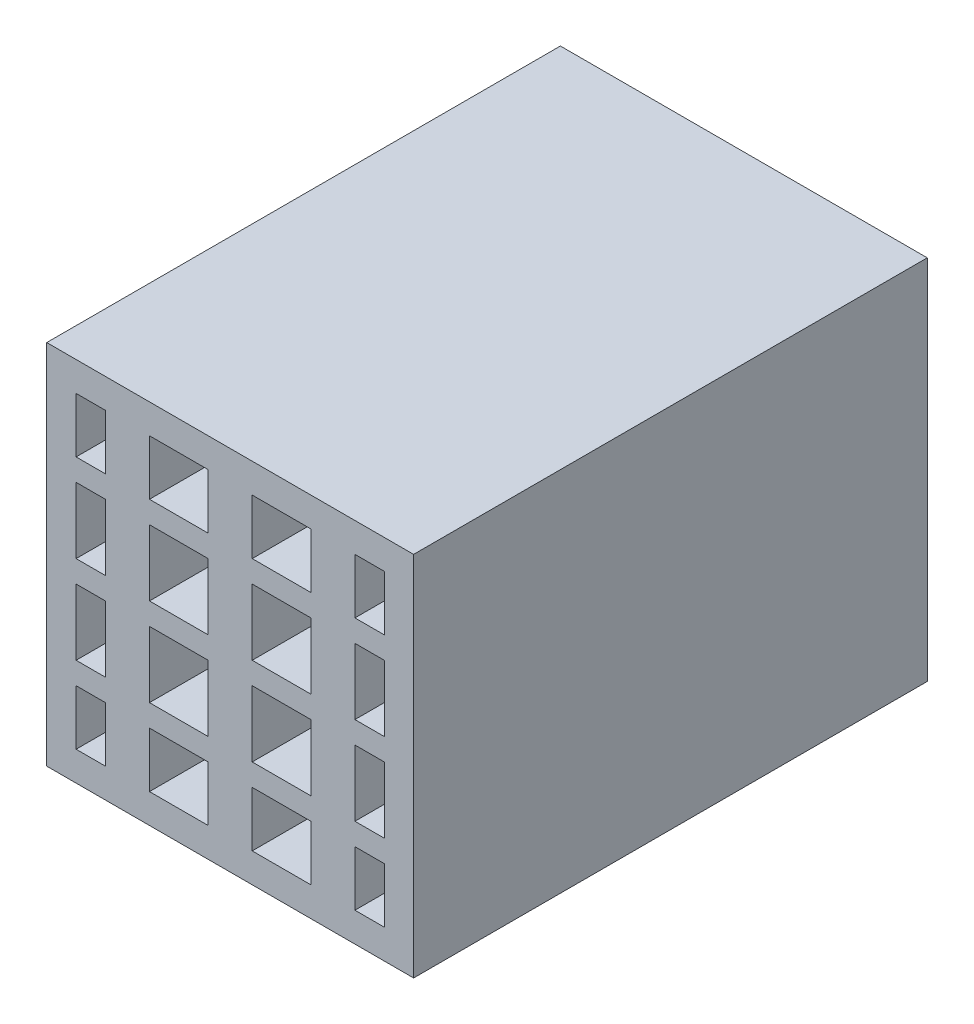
SolidWorks part; units mm, degrees
ref_plane "前视基准面" through (0, 0, 0) normal (0, 0, 1) x (1, 0, 0)
ref_plane "上视基准面" through (0, 0, 0) normal (0, 1, 0) x (1, 0, 0)
ref_plane "右视基准面" through (0, 0, 0) normal (1, 0, 0) x (0, 0, -1)
sketch "草图8" plane through (0, 0, 0) normal (0, 0, 1) x (1, 0, 0)
  line L0 (0, 7.8741) -> (0, -9.2542) construction
  line L1 (-12.5, -12.5) -> (12.5, -12.5)
  line L2 (-12.5, -12.5) -> (-12.5, 12.5)
  line L3 (-12.5, 12.5) -> (12.5, 12.5)
  line L4 (12.5, -12.5) -> (12.5, 12.5)
  line L5 (-12.5, -12.5) -> (12.5, 12.5) construction
  line L6 (-12.5, 12.5) -> (12.5, -12.5) construction
  line L7 (-16.0619, 0) -> (15.5648, 0) construction
  line L8 (-3.5, 7.8741) -> (-3.5, -9.2542) construction
  line L9 (-9.5, 7.8741) -> (-9.5, -9.2542) construction
  line L10 (5.5, 10.5) -> (1.5, 10.5)
  line L15 (-5.5, -10.5) -> (-1.5, -10.5)
  line L20 (-5.5, -10.5) -> (-5.5, 10.5)
  line L21 (-5.5, 10.5) -> (-1.5, 10.5)
  line L26 (-1.5, -10.5) -> (-1.5, 10.5)
  line L27 (-5.5, -10.5) -> (-1.5, 10.5) construction
  line L28 (-5.5, 10.5) -> (-1.5, -10.5) construction
  line L29 (-10.5, -10.5) -> (-8.5, -10.5)
  line L30 (-10.5, -10.5) -> (-10.5, 10.5)
  line L31 (-10.5, 10.5) -> (-8.5, 10.5)
  line L32 (-8.5, -10.5) -> (-8.5, 10.5)
  line L33 (-10.5, -10.5) -> (-8.5, 10.5) construction
  line L34 (-10.5, 10.5) -> (-8.5, -10.5) construction
  line L35 (1.5, -10.5) -> (1.5, 10.5)
  line L36 (5.5, -10.5) -> (1.5, -10.5)
  line L37 (5.5, -10.5) -> (5.5, 10.5)
  line L38 (10.5, 10.5) -> (8.5, 10.5)
  line L39 (8.5, -10.5) -> (8.5, 10.5)
  line L40 (10.5, -10.5) -> (8.5, -10.5)
  line L41 (10.5, -10.5) -> (10.5, 10.5)
  point P0 (0, 0)
  point P14 (-7, 0)
  point P15 (-3.5, 0)
  point P17 (-3, 0)
  point P21 (-9.5, 0)
  point P22 (-9, 0)
  dimension "D1" = 3.5
  dimension "D2" = 6
extrude "凸台-拉伸7" add sketch "草图8" along normal blind 25
sketch "草图9" plane through (0, 0, 0) normal (0, 0, -1) x (-1, 0, 0)
  line L1 (-12.5, -12.5) -> (12.5, -12.5)
  line L2 (-12.5, -12.5) -> (-12.5, 12.5)
  line L3 (-12.5, 12.5) -> (12.5, 12.5)
  line L4 (12.5, -12.5) -> (12.5, 12.5)
  line L5 (-12.5, -12.5) -> (12.5, 12.5) construction
  line L6 (-12.5, 12.5) -> (12.5, -12.5) construction
  point P0 (0, 0)
extrude "凸台-拉伸8" add sketch "草图9" along normal blind 2
sketch "草图11" plane through (0, 0, -2) normal (0, 0, -1) x (-1, 0, 0)
  line L1 (-12.5, -12.5) -> (12.5, -12.5)
  line L2 (-12.5, -12.5) -> (-12.5, 12.5)
  line L3 (-12.5, 12.5) -> (12.5, 12.5)
  line L4 (12.5, -12.5) -> (12.5, 12.5)
  line L5 (-12.5, -12.5) -> (12.5, 12.5) construction
  line L6 (-12.5, 12.5) -> (12.5, -12.5) construction
  point P0 (0, 0)
extrude "凸台-拉伸9" add sketch "草图11" along normal blind 6
sketch "草图12" plane through (0, 0, -8) normal (0, 0, -1) x (-1, 0, 0)
  line L1 (-10.5, -10.5) -> (10.5, -10.5)
  line L2 (-10.5, -10.5) -> (-10.5, 10.5)
  line L3 (-10.5, 10.5) -> (10.5, 10.5)
  line L4 (10.5, -10.5) -> (10.5, 10.5)
  line L5 (-10.5, -10.5) -> (10.5, 10.5) construction
  line L6 (-10.5, 10.5) -> (10.5, -10.5) construction
  point P0 (0, 0)
extrude "切除-拉伸1" cut sketch "草图12" against normal blind 6
sketch "草图13" plane through (0, 0, -8) normal (0, 0, -1) x (-1, 0, 0)
  line L1 (-12.5, -12.5) -> (12.5, -12.5)
  line L2 (-12.5, -12.5) -> (-12.5, 12.5)
  line L3 (-12.5, 12.5) -> (12.5, 12.5)
  line L4 (12.5, -12.5) -> (12.5, 12.5)
  line L5 (-12.5, -12.5) -> (12.5, 12.5) construction
  line L6 (-12.5, 12.5) -> (12.5, -12.5) construction
  point P0 (0, 0)
extrude "凸台-拉伸10" add sketch "草图13" along normal blind 2
sketch "草图14" plane through (0, 0, 25) normal (0, 0, 1) x (1, 0, 0)
  line L0 (-16.6961, 0) -> (20.7273, 0) construction
  line L1 (-12.5, 12.5) -> (-12.5, -12.5) construction
  line L2 (12.5, -0.75) -> (-12.5, -0.75)
  line L3 (12.5, -0.75) -> (12.5, 0.75)
  line L4 (12.5, 0.75) -> (-12.5, 0.75)
  line L5 (-12.5, -0.75) -> (-12.5, 0.75)
  line L6 (12.5, -0.75) -> (-12.5, 0.75) construction
  line L7 (12.5, 0.75) -> (-12.5, -0.75) construction
  line L12 (12.5, 5.25) -> (-12.5, 5.25)
  line L13 (12.5, 5.25) -> (12.5, 6.75)
  line L14 (12.5, 6.75) -> (-12.5, 6.75)
  line L15 (-12.5, 5.25) -> (-12.5, 6.75)
  line L16 (12.5, 5.25) -> (-12.5, 6.75) construction
  line L17 (12.5, 6.75) -> (-12.5, 5.25) construction
  line L18 (12.5, -6.75) -> (-12.5, -5.25) construction
  line L19 (12.5, -5.25) -> (-12.5, -6.75) construction
  line L20 (-12.5, -5.25) -> (-12.5, -6.75)
  line L21 (12.5, -6.75) -> (-12.5, -6.75)
  line L22 (12.5, -5.25) -> (12.5, -6.75)
  line L23 (12.5, -5.25) -> (-12.5, -5.25)
  point P3 (0, 0)
  point P11 (0, 6)
  point P19 (0, -6)
  dimension "D1" = 2
extrude "凸台-拉伸11" add sketch "草图14" against normal blind 25
